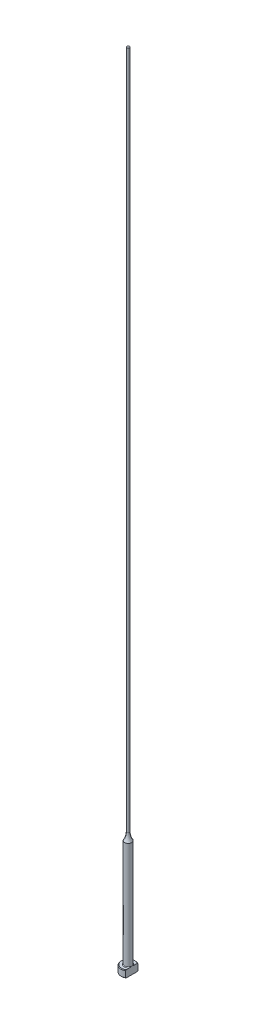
SolidWorks part; units mm, degrees
ref_plane "Front Plane" through (0, 0, 0) normal (0, 0, 1) x (1, 0, 0)
ref_plane "Top Plane" through (0, 0, 0) normal (0, 1, 0) x (1, 0, 0)
ref_plane "Right Plane" through (0, 0, 0) normal (1, 0, 0) x (0, 0, -1)
sketch "Sketch1" plane through (0, 0, 0) normal (0, 0, 1) x (1, 0, 0)
  line L0 (0, 259.9588) -> (0, -15.1925) construction
  line L1 (0, 0) -> (-3.175, 0)
  line L2 (-3.175, 0) -> (-3.175, 3.175)
  line L3 (-3.175, 3.175) -> (-1.5875, 3.175)
  line L4 (-0.5944, 54.2098) -> (-0.5944, 355.6)
  line L5 (-0.5944, 355.6) -> (0, 355.6)
  line L6 (0, 355.6) -> (0, 0)
  line L7 (-1.5875, 3.175) -> (-1.5875, 50.8)
  arc A0 (-1.5875, 50.8) -> (-0.5944, 54.2098) centre (-6.9444, 54.2098) ccw
  point P13 (-1.5875, 0)
  dimension "D1" = 6.35
  dimension "L" = 355.6
  dimension "D2" = 3.175
  dimension "H" = 6.35
  dimension "T" = 3.175
  dimension "D" = 1.1887
  dimension "S" = 50.8
revolve "Revolve1" add sketch "Sketch1" angle 360 about L0
chamfer "Chamfer1" distance 0.254 angle 45 2 edges at (0, 3.175, 3.175) (0, 0, 3.175)
fillet "Fillet1" radius 0.254 1 edges at (0, 3.175, 1.5875)
sketch "Sketch2" plane through (0, 0, 0) normal (0, 1, 0) x (1, 0, 0)
  line L0 (1.5875, -2.7496) -> (1.5875, 2.7496)
  circle A0 centre (0, 0) radius 3.175 construction
  arc A2 (1.5875, -2.7496) -> (1.5875, 2.7496) centre (0, 0) ccw
  circle A3 centre (0, 0) radius 3.175 construction
  circle A4 centre (0, 0) radius 1.5875 construction
extrude "Key Head" cut sketch "Sketch2" along normal up to next
